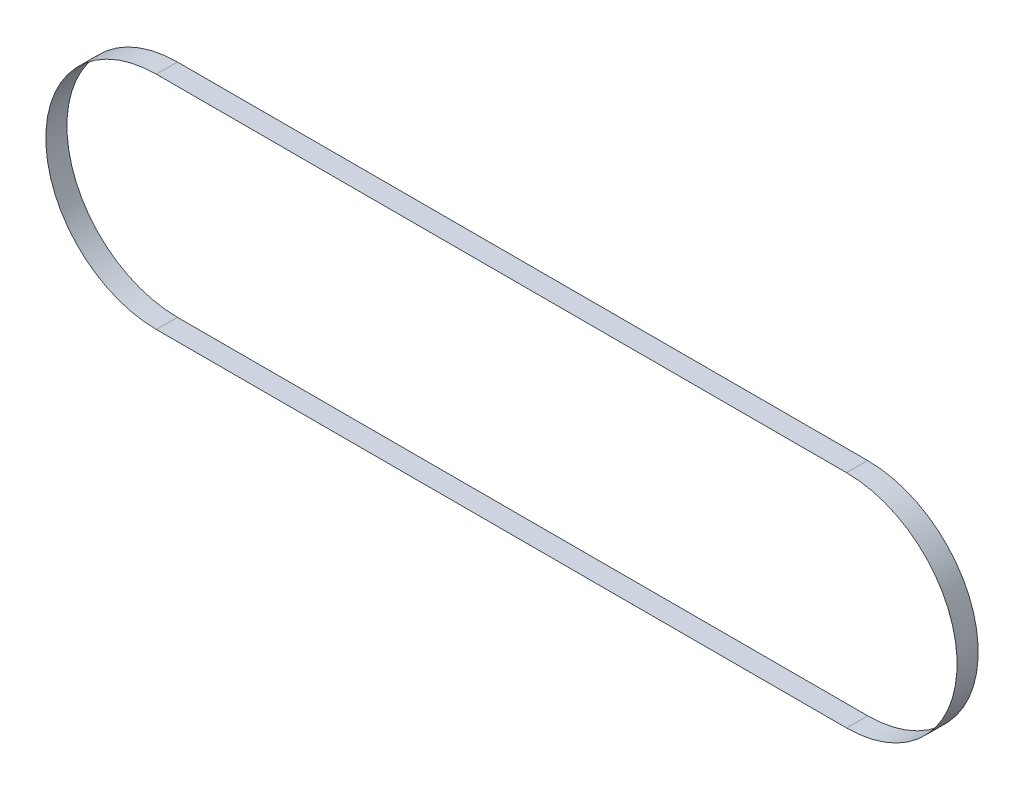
SolidWorks part; units mm, degrees
ref_plane "Ebene vorne" through (0, 0, 0) normal (0, 0, 1) x (1, 0, 0)
ref_plane "Ebene oben" through (0, 0, 0) normal (0, 1, 0) x (1, 0, 0)
ref_plane "Ebene rechts" through (0, 0, 0) normal (1, 0, 0) x (0, 0, -1)
sketch "Skizze2" plane through (0, 0, 0) normal (0, 0, 1) x (1, 0, 0)
  line L0 (0, 0) -> (1, 0) construction
  line L1 (0, 0) -> (0, 1) construction
  line L2 (253.47, -40.595) -> (0, -40.595)
  line L3 (0, 40.595) -> (253.47, 40.595)
  arc A0 (253.47, 40.595) -> (253.47, -40.595) centre (253.47, 0) cw
  arc A1 (0, -40.595) -> (0, 40.595) centre (0, 0) cw
extrude "Linear-Austragen-Dünn1" add sketch "Skizze2" along normal mid plane 7.75 thin
